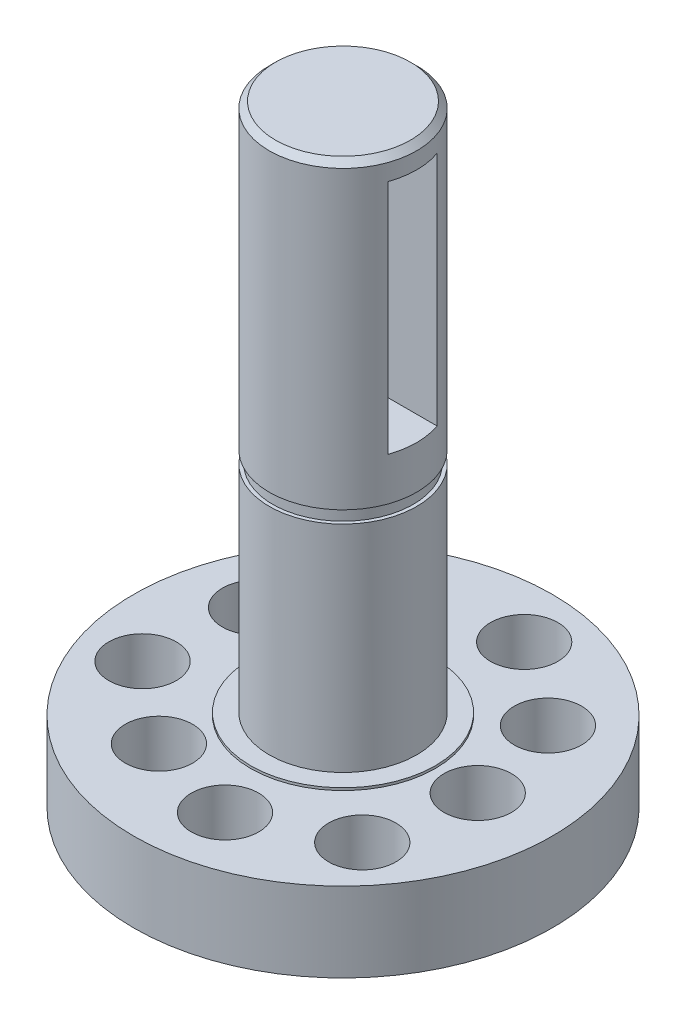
SolidWorks part; units mm, degrees
ref_plane "Front Plane" through (0, 0, 0) normal (0, 0, 1) x (1, 0, 0)
ref_plane "Top Plane" through (0, 0, 0) normal (0, 1, 0) x (1, 0, 0)
ref_plane "Right Plane" through (0, 0, 0) normal (1, 0, 0) x (0, 0, -1)
sketch "Sketch1" plane through (0, 0, 0) normal (0, 1, 0) x (1, 0, 0)
  circle A0 centre (0, 0) radius 17
  dimension "D1" = 34
extrude "Extrude1" add sketch "Sketch1" along normal blind 6.46
sketch "Sketch2" plane through (0, 0, 0) normal (0, -1, 0) x (1, 0, 0)
  circle A0 centre (0, 0) radius 7.25
  dimension "D1" = 14.5
extrude "flange relief" cut sketch "Sketch2" against normal blind 2
sketch "Sketch3" plane through (0, 6.46, 0) normal (0, 1, 0) x (-1, 0, 0)
  circle A0 centre (0, 0) radius 5.985
  dimension "D1" = 11.97
extrude "shaft " add sketch "Sketch3" along normal blind 43.18
sketch "Sketch4" plane through (0, 6.46, 0) normal (0, 1, 0) x (-1, 0, 0)
  circle A0 centre (0, 0) radius 7.5
  dimension "D1" = 15
extrude "spring washer seat" add sketch "Sketch4" along normal blind 0.2
sketch "Sketch5" plane through (0, 0, 0) normal (1, 0, 0) x (0, 0, -1)
  line L0 (0, 0) -> (0, 23.7879) construction
  line L1 (5.7, 25.13) -> (11.2459, 25.13)
  line L2 (5.7, 25.13) -> (5.7, 24.13)
  line L3 (5.7, 24.13) -> (11.2459, 24.13)
  line L4 (11.2459, 25.13) -> (11.2459, 24.13)
  line L6 (7.5, 6.66) -> (-7.5, 6.66) construction
  dimension "D1" = 18.47
  dimension "D2" = 1
  dimension "D3" = 11.4
revolve "snap ring groove" cut sketch "Sketch5" angle 360 about L0
sketch "Sketch6" plane through (0, 0, 0) normal (0, -1, 0) x (1, 0, 0)
  circle A0 centre (10.9411, 0) radius 2.7368
  circle A3 centre (0, 0) radius 10.9411 construction
  dimension "D1" = 5.4737
  dimension "D2" = 21.8821
extrude "inside hole" cut sketch "Sketch6" against normal through all
chamfer "Chamfer1" distance 0.5 angle 45 1 edges at (0, 49.64, 5.985)
hole_wizard "1/4-28 Tapped Hole1" positions "Sketch9" profile "Sketch8" tap size "1/4-28" standard "Ansi Inch"
sketch "Sketch9" plane through (0, 91.55, 0) normal (0, 1, 0) x (-1, 0, 0)
  point P0 (0, 0)
sketch "Sketch8" plane through (0, 91.55, 0) normal (1, 0, 0) x (0, 0, 1)
  line L0 (0, 0) -> (0, 17.0457)
  line L1 (0, 17.0457) -> (2.7051, 15.4203)
  line L2 (2.7051, 15.4203) -> (2.7051, 12.7)
  line L3 (2.7051, 12.7) -> (3.175, 12.7)
  line L4 (3.175, 12.7) -> (3.175, 0)
  line L5 (3.175, 0) -> (0, 0)
  line L10 (0, 17.0457) -> (-2.7051, 15.4203) construction
  line L11 (0, -6.35) -> (0, 107.95) construction
  dimension "Tap Drill Dia." = 5.4102
  dimension "Tap Drill Depth" = 15.4203
  dimension "Thread Major Dia." = 6.35
  dimension "Thread Depth" = 12.7
  dimension "Drill Angle" = 118
pattern_circular "CirPattern1" count 3 over 360 about axis through (0, 0, 0) along (0, 1, 0) of "inside hole"
sketch "Sketch10" plane through (0, 0, 0) normal (0, -1, 0) x (1, 0, 0)
  line L0 (0, 0) -> (-5.4705, 9.4752) construction
  line L1 (0, 0) -> (2.051, 11.6316) construction
  circle A0 centre (2.051, 11.6316) radius 2.7369
  circle A1 centre (0, 0) radius 11.811 construction
  dimension "D1" = 23.622
  dimension "D3" = 5.4737
  dimension "D2" = 40
extrude "middle hole" cut sketch "Sketch10" against normal through all
pattern_circular "CirPattern2" count 3 over 360 about axis through (0, 0, 0) along (0, 1, 0) of "middle hole"
sketch "Sketch11" plane through (0, 0, 0) normal (0, -1, 0) x (1, 0, 0)
  line L0 (9.7288, 8.1634) -> (0, 0) construction
  line L1 (0, 0) -> (2.051, 11.6316) construction
  circle A0 centre (9.7288, 8.1634) radius 2.7368
  circle A1 centre (0, 0) radius 12.7 construction
  dimension "D1" = 5.4737
  dimension "D2" = 25.4
  dimension "D3" = 40
extrude "outside hole" cut sketch "Sketch11" against normal through all
pattern_circular "CirPattern3" count 3 over 360 about axis through (0, 0, 0) along (0, 1, 0) of "outside hole"
chamfer "Chamfer2" distance 0.254 angle 20 9 edges at (-8.7285, 0, -2.6712) (-7.8407, 0, -8.1068) (-0.1648, 0, -11.1386) (6.6776, 0, -6.2235) (10.9411, 0, -2.7368) (9.7288, 0, 5.4266) (2.051, 0, 8.8947) (-3.1003, 0, 10.8437) (-9.5639, 0, 5.7121)
sketch "Sketch12" [suppressed] plane through (0, 91.55, 0) normal (0, 1, 0) x (-1, 0, 0)
  line L1 (-6.2763, 5.334) -> (6.4178, 5.334)
  line L2 (-6.2763, 5.334) -> (-6.2763, 8.3542)
  line L3 (-6.2763, 8.3542) -> (6.4178, 8.3542)
  line L4 (6.4178, 5.334) -> (6.4178, 8.3542)
  dimension "D1" = 5.334
extrude "Cut-Extrude1" [suppressed] cut sketch "Sketch12" against normal blind 19.05
sketch "Sketch13" plane through (0, 49.64, 0) normal (0, 1, 0) x (-1, 0, 0)
  line L0 (0, 0) -> (3.7752, 0) construction
  line L1 (-5.7342, -1.7145) -> (5.7342, -1.7145)
  line L3 (-5.7342, 1.7145) -> (5.7342, 1.7145)
  circle A1 centre (0, 0) radius 5.985 construction
  arc A2 (-5.7342, 1.7145) -> (-5.7342, -1.7145) centre (0, 0) ccw
  arc A3 (5.7342, -1.7145) -> (5.7342, 1.7145) centre (0, 0) ccw
  dimension "D1" = 3.429
extrude "Cut-Extrude2" [suppressed] cut sketch "Sketch13" against normal blind 7.62 flip side to cut
sketch "Sketch14" plane through (0, 0, 0) normal (1, 0, 0) x (0, 0, -1)
  line L0 (5.485, 49.64) -> (-5.485, 49.64) construction
  line L1 (-1.9939, 47.7985) -> (1.9939, 47.7985)
  line L2 (-1.9939, 47.7985) -> (-1.9939, 28.6215)
  line L3 (-1.9939, 28.6215) -> (1.9939, 28.6215)
  line L4 (1.9939, 47.7985) -> (1.9939, 28.6215)
  dimension "D1" = 1.9939
  dimension "D2" = 3.9878
  dimension "D3" = 19.177
  dimension "D4" = 1.8415
extrude "Cut-Extrude3" cut sketch "Sketch14" along normal through all
